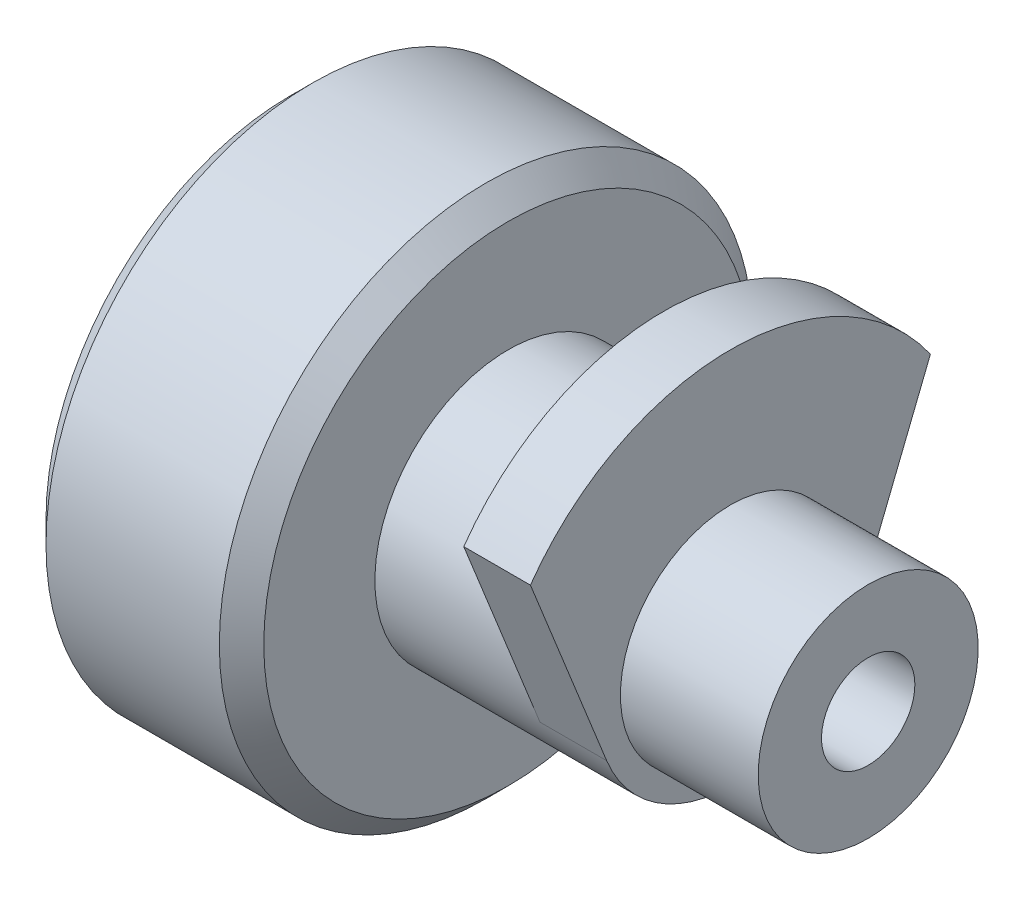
SolidWorks part; units mm, degrees
ref_plane "Front Plane" through (0, 0, 0) normal (0, 0, 1) x (1, 0, 0)
ref_plane "Top Plane" through (0, 0, 0) normal (0, 1, 0) x (1, 0, 0)
ref_plane "Right Plane" through (0, 0, 0) normal (1, 0, 0) x (0, 0, -1)
sketch "Sketch1" plane through (0, 0, 0) normal (0, 0, 1) x (1, 0, 0)
  line L0 (16.8, 0) -> (26, 0)
  line L1 (26, 0) -> (26, 4.95)
  line L2 (26, 4.95) -> (19.8, 4.95)
  line L3 (19.8, 4.95) -> (19.8, 6)
  line L4 (19.8, 6) -> (9.8, 6)
  line L5 (9.8, 6) -> (9.8, 11)
  line L6 (9.8, 11) -> (8.8, 12)
  line L7 (8.8, 12) -> (1, 12)
  line L8 (1, 12) -> (0, 11)
  line L9 (0, 11) -> (0, 2.5)
  line L10 (0, 2.5) -> (16.8, 2.5)
  line L11 (16.8, 2.5) -> (16.8, 0)
  line L12 (16.8, 0) -> (0, 0) construction
  line L13 (0, 0) -> (0, 2.5) construction
  dimension "D1" = 135
  dimension "D2" = 135
  dimension "D3" = 1
  dimension "D4" = 1
  dimension "D5" = 6.2
  dimension "D6" = 10
  dimension "D7" = 26
  dimension "D8" = 4.95
  dimension "D9" = 6
  dimension "D10" = 12
  dimension "D11" = 2.5
  dimension "D12" = 16.8
revolve "Revolve1" add sketch "Sketch1" angle 360 about L0
hole_wizard "M5 Tapped Hole1" positions "3DSketch1" profile "Sketch2" tap size "M5" standard "ISO"
sketch3d "3DSketch1"
  line L0 (26, 0, 0) -> (19.8, 0, 0) construction
  point P0 (26, 0, 0)
sketch "Sketch2" plane through (26, 0, 0) normal (0, 1, 0) x (0, 0, -1)
  line L0 (0, 0) -> (0, 15.2618)
  line L1 (0, 15.2618) -> (2.1, 14)
  line L2 (2.1, 14) -> (2.1, 0)
  line L5 (2.1, 0) -> (0, 0)
  line L10 (0, 15.2618) -> (-2.1, 14) construction
  line L11 (0, -6.35) -> (0, 107.95) construction
  dimension "Tap Drill Dia." = 4.2
  dimension "Tap Drill Depth" = 14
  dimension "Drill Angle" = 118
sketch "Sketch3" plane through (19.8, 0, 0) normal (1, 0, 0) x (0, 0, -1)
  line L0 (0, -6) -> (0, 11) construction
  line L1 (9, 6.3246) -> (5.5691, -2.2328)
  line L2 (-9, 6.3246) -> (-5.5691, -2.2328)
  circle A0 centre (0, 0) radius 11 construction
  circle A1 centre (0, 0) radius 6 construction
  arc A2 (-5.5691, -2.2328) -> (5.5691, -2.2328) centre (0, 0) ccw
  arc A3 (9, 6.3246) -> (-9, 6.3246) centre (0, 0) ccw
extrude "Extrude1" add sketch "Sketch3" against normal blind 3
